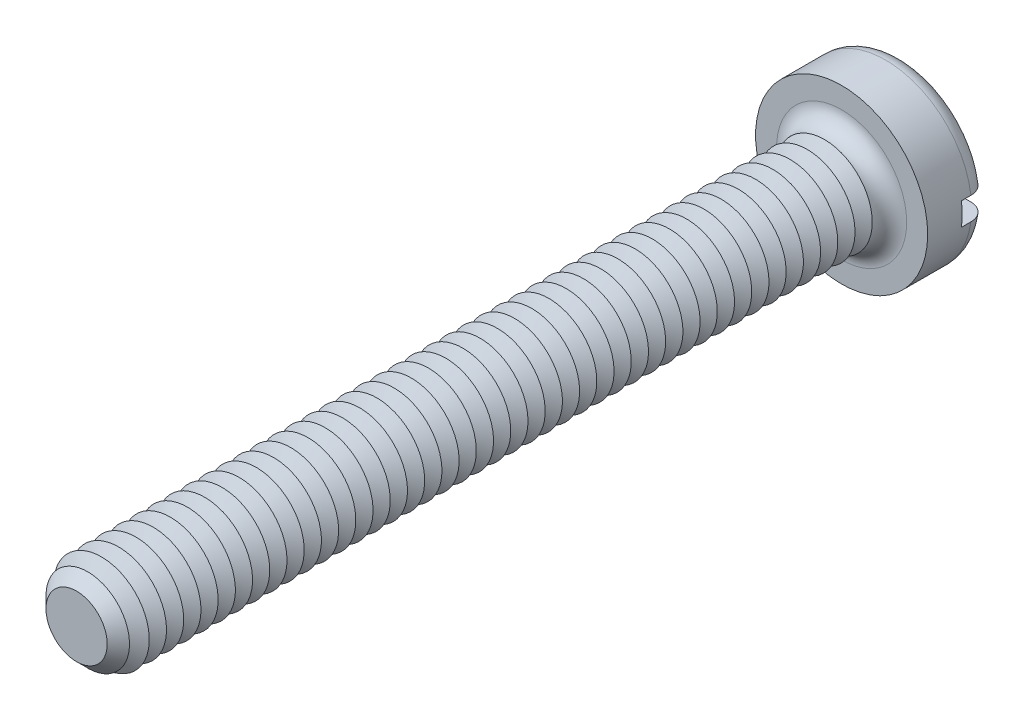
SolidWorks part; units mm, degrees
ref_plane "Front Plane" through (0, 0, 0) normal (0, 0, 1) x (1, 0, 0)
ref_plane "Top Plane" through (0, 0, 0) normal (0, 1, 0) x (1, 0, 0)
ref_plane "Right Plane" through (0, 0, 0) normal (1, 0, 0) x (0, 0, -1)
sketch "Sketch3" plane through (0, 0, 0) normal (0, 0, 1) x (1, 0, 0)
  circle A0 centre (0, 0) radius 2.25
  dimension "D1" = 4.5
extrude "Boss-Extrude2" add sketch "Sketch3" against normal blind 1.6
sketch "Sketch4" plane through (0, 0, 0) normal (0, 0, 1) x (1, 0, 0)
  circle A0 centre (0, 0) radius 1.25
  dimension "D1" = 2.5
extrude "Boss-Extrude3" add sketch "Sketch4" along normal blind 20
fillet "Fillet1" radius 0.45 2 edges at (2.25, 0, -1.6) (1.25, 0, 0)
chamfer "Chamfer1" distance 0.45 angle 45 1 edges at (1.25, 0, 20)
sketch "Sketch5" plane through (0, 0, 0) normal (1, 0, 0) x (0, 0, -1)
  line L0 (1.6944, 0) -> (-7.6738, 0) construction
sketch "Sketch6" plane through (0, 0, 0) normal (1, 0, 0) x (0, 0, -1)
  line L0 (-0.45, 1.25) -> (-0.675, 0.8603)
  line L1 (-0.675, 0.8603) -> (-0.9, 1.25)
  line L2 (-0.45, 1.25) -> (-19.55, 1.25) construction
  line L3 (-0.9, 1.25) -> (-0.45, 1.25)
  dimension "D1" = 0.45
revolve "Cut-Revolve1" cut sketch "Sketch6" angle 360 about L0
pattern_linear "LPattern1" count 43 spacing 0.45 along (0, 0, 1) of "Cut-Revolve1"
sketch "Sketch8" plane through (0, 0, -1.6) normal (0, 0, -1) x (-1, 0, 0)
  line L1 (2.25, -0.3) -> (-2.25, -0.3)
  line L2 (2.25, -0.3) -> (2.25, 0.3)
  line L3 (2.25, 0.3) -> (-2.25, 0.3)
  line L4 (-2.25, -0.3) -> (-2.25, 0.3)
  line L5 (2.25, -0.3) -> (-2.25, 0.3) construction
  line L6 (2.25, 0.3) -> (-2.25, -0.3) construction
  point P0 (0, 0)
  dimension "D1" = 4.5
  dimension "D2" = 0.6
extrude "Cut-Extrude1" cut sketch "Sketch8" against normal blind 0.7
